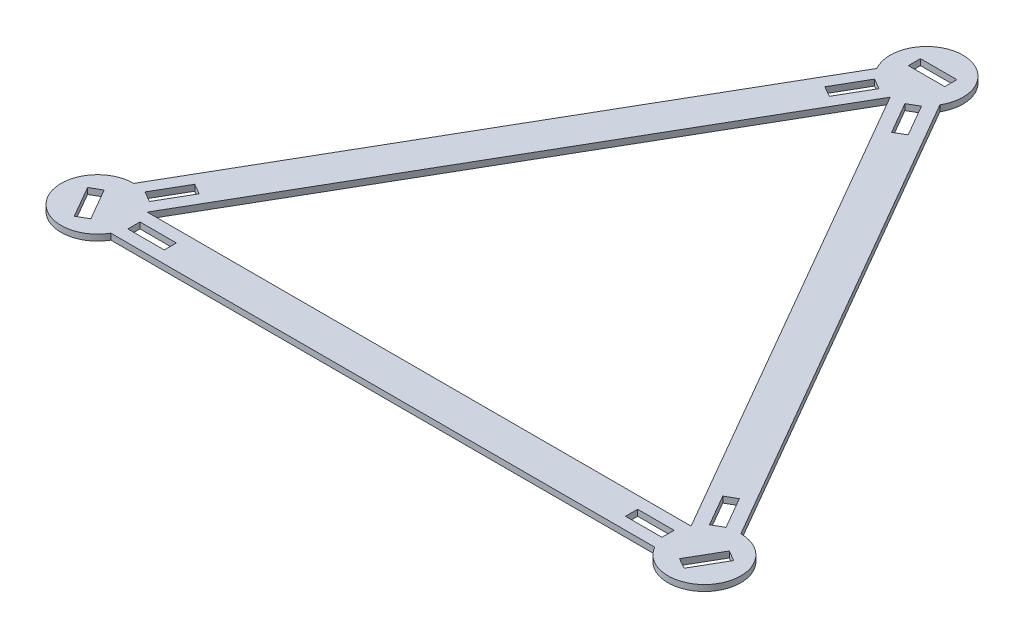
SolidWorks part; units mm, degrees
ref_plane "Alzado" through (0, 0, 0) normal (0, 0, 1) x (1, 0, 0)
ref_plane "Planta" through (0, 0, 0) normal (0, 1, 0) x (1, 0, 0)
ref_plane "Vista lateral" through (0, 0, 0) normal (1, 0, 0) x (0, 0, -1)
sketch "Croquis1" plane through (0, 0, 0) normal (0, 1, 0) x (1, 0, 0)
  line L0 (0, 0) -> (500, 0) construction
  line L1 (500, 0) -> (250, 433.0127) construction
  line L2 (250, 433.0127) -> (0, 0) construction
  line L3 (25.9808, 15) -> (474.0192, 15)
  line L4 (474.0192, 15) -> (250, 403.0127)
  line L5 (250, 403.0127) -> (25.9808, 15)
  line L6 (25.9808, -15) -> (474.0192, -15)
  line L7 (275.9808, 418.0127) -> (500, 30)
  line L8 (224.0192, 418.0127) -> (0, 30)
  line L9 (250, 463.0127) -> (-25.9808, -15) construction
  line L10 (525.9808, -15) -> (250, 463.0127) construction
  line L11 (0, 0) -> (375, 216.5064) construction
  line L12 (230.6699, 409.5319) -> (239.3301, 404.5319)
  line L13 (239.3301, 404.5319) -> (224.3301, 378.5512)
  line L14 (250, 433.0127) -> (250, 403.0127) construction
  line L15 (224.3301, 378.5512) -> (215.6699, 383.5512)
  line L16 (215.6699, 383.5512) -> (230.6699, 409.5319)
  line L17 (512.9904, 7.5) -> (250, 463.0127) construction
  line L18 (235, 443.0127) -> (265, 443.0127)
  line L19 (235, 443.0127) -> (235, 433.0127)
  line L20 (-25.9808, -15) -> (500, -15) construction
  line L21 (235, 433.0127) -> (265, 433.0127)
  line L22 (265, 443.0127) -> (265, 433.0127)
  line L23 (235, 443.0127) -> (265, 433.0127) construction
  line L24 (235, 433.0127) -> (265, 443.0127) construction
  line L25 (250, 463.0127) -> (-25.9808, -15) construction
  line L26 (284.3301, 383.5512) -> (269.3301, 409.5319)
  line L27 (275.6699, 378.5512) -> (284.3301, 383.5512)
  line L28 (260.6699, 404.5319) -> (275.6699, 378.5512)
  line L29 (269.3301, 409.5319) -> (260.6699, 404.5319)
  line L30 (0, 0) -> (500, 0) construction
  line L31 (500, 0) -> (125, 216.5064) construction
  line L32 (489.3301, 28.4808) -> (480.6699, 23.4808)
  line L33 (480.6699, 23.4808) -> (465.6699, 49.4615)
  line L34 (465.6699, 49.4615) -> (474.3301, 54.4615)
  line L35 (474.3301, 54.4615) -> (489.3301, 28.4808)
  line L36 (516.1603, 7.9904) -> (501.1603, -17.9904)
  line L37 (516.1603, 7.9904) -> (507.5, 12.9904)
  line L38 (507.5, 12.9904) -> (492.5, -12.9904)
  line L39 (501.1603, -17.9904) -> (492.5, -12.9904)
  line L40 (440, -5) -> (470, -5)
  line L41 (440, 5) -> (440, -5)
  line L42 (470, 5) -> (440, 5)
  line L43 (470, -5) -> (470, 5)
  line L44 (500, 0) -> (474.0192, 15) construction
  line L45 (516.1603, 7.9904) -> (492.5, -12.9904) construction
  line L46 (507.5, 12.9904) -> (501.1603, -17.9904) construction
  line L47 (30, -5) -> (30, 5)
  line L48 (30, 5) -> (60, 5)
  line L49 (60, 5) -> (60, -5)
  line L50 (60, -5) -> (30, -5)
  line L51 (-1.1603, -17.9904) -> (-16.1603, 7.9904)
  line L52 (-1.1603, -17.9904) -> (7.5, -12.9904)
  line L53 (7.5, -12.9904) -> (-7.5, 12.9904)
  line L54 (-16.1603, 7.9904) -> (-7.5, 12.9904)
  line L55 (25.6699, 54.4615) -> (10.6699, 28.4808)
  line L56 (34.3301, 49.4615) -> (25.6699, 54.4615)
  line L57 (19.3301, 23.4808) -> (34.3301, 49.4615)
  line L58 (10.6699, 28.4808) -> (19.3301, 23.4808)
  line L59 (0, 0) -> (25.9808, 15) construction
  line L60 (-1.1603, -17.9904) -> (-7.5, 12.9904) construction
  line L61 (7.5, -12.9904) -> (-16.1603, 7.9904) construction
  line L62 (-25.9808, -15) -> (525.9808, -15) construction
  arc A0 (275.9808, 418.0127) -> (224.0192, 418.0127) centre (250, 433.0127) ccw
  arc A1 (474.0192, -15) -> (500, 30) centre (500, 0) ccw
  arc A2 (0, 30) -> (25.9808, -15) centre (0, 0) ccw
  point P13 (250, 144.3376)
  point P19 (235, 407.0319)
  point P30 (265, 407.0319)
  point P43 (485, 25.9808)
  point P54 (470, 0)
  point P61 (30, 0)
  point P72 (15, 25.9808)
  point P73 (250, 144.3376)
  dimension "D1" = 500
  dimension "D4" = 15
  dimension "D5" = 30
  dimension "D6" = 10
  dimension "D7" = 30
  dimension "D8" = 3
  dimension "D9" = 30
  dimension "D2" = 15
  dimension "D3" = 15
extrude "Saliente-Extruir1" add sketch "Croquis1" along normal blind 5
